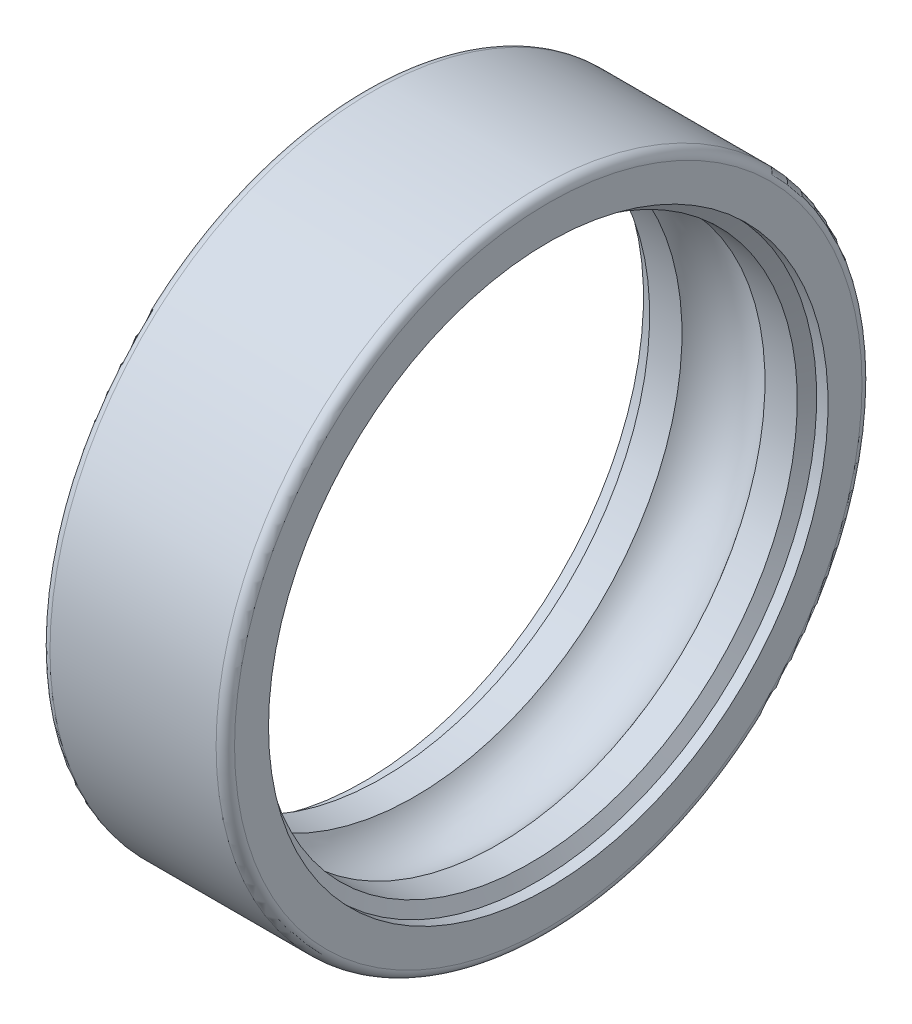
SolidWorks part; units mm, degrees
ref_plane "Face" through (0, 0, 0) normal (0, 0, 1) x (1, 0, 0)
ref_plane "Dessus" through (0, 0, 0) normal (0, 1, 0) x (1, 0, 0)
ref_plane "Droite" through (0, 0, 0) normal (1, 0, 0) x (0, 0, -1)
sketch "Esquisse1" plane through (0, 0, 0) normal (0, 0, 1) x (1, 0, 0)
  line L0 (0, 17) -> (0, 15.16)
  line L1 (0, 15.16) -> (0.6155, 15.16)
  line L2 (0.6155, 15.16) -> (1, 14.494)
  line L3 (1, 14.494) -> (2.751, 14.494)
  line L4 (7.249, 14.494) -> (9, 14.494)
  line L5 (9, 14.494) -> (9.3845, 15.16)
  line L6 (9.3845, 15.16) -> (10, 15.16)
  line L7 (10, 15.16) -> (10, 17)
  line L8 (9.5, 17.5) -> (0.5, 17.5)
  line L9 (10, 0) -> (0, 0) construction
  arc A0 (2.751, 14.494) -> (7.249, 14.494) centre (5, 13) cw
  arc A1 (10, 17) -> (9.5, 17.5) centre (9.5, 17) ccw
  arc A2 (0.5, 17.5) -> (0, 17) centre (0.5, 17) ccw
revolve "Révolution1" add sketch "Esquisse1" angle 360 about L9
